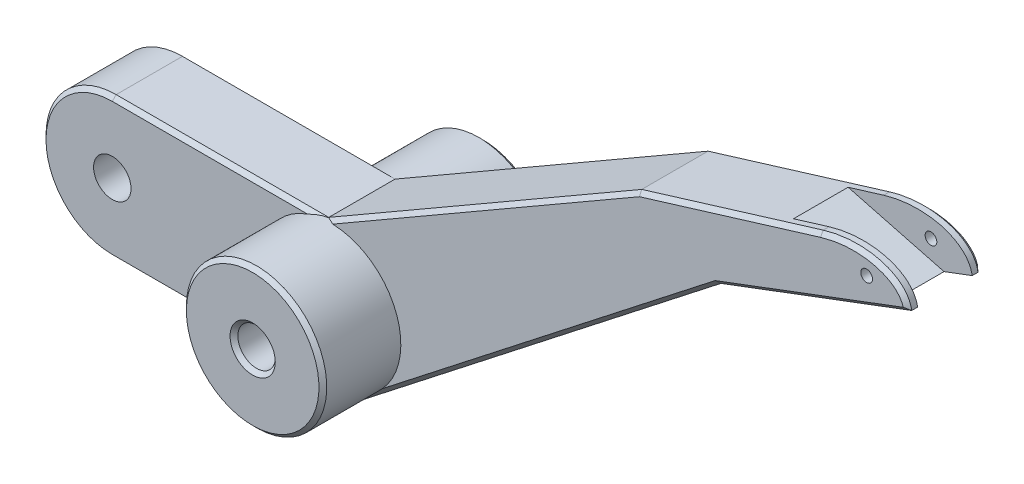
SolidWorks part; units mm, degrees
other "Markup1"
sketch "Sketch7" plane through (10, 10, 14.75) normal (0, 0, 1) x (1, 0, 0)
ref_plane "Front Plane" through (0, 0, 0) normal (0, 0, 1) x (1, 0, 0)
ref_plane "Top Plane" through (0, 0, 0) normal (0, 1, 0) x (1, 0, 0)
ref_plane "Right Plane" through (0, 0, 0) normal (1, 0, 0) x (0, 0, -1)
sketch "Sketch1" plane through (0, 0, 0) normal (0, 0, 1) x (1, 0, 0)
  line L14 (10, 28) -> (46.2616, 28)
  line L15 (10, 28) -> (10, 10)
  line L16 (10, 10) -> (50.7138, 10)
  line L23 (46.2616, 28) -> (86.3978, 51.1726)
  line L24 (50.7138, 10) -> (96.5513, 45.8122)
  line L25 (86.3978, 51.1726) -> (121.4078, 61.8763)
  line L28 (121.0092, 55.0295) -> (96.5513, 45.8122)
  line L29 (121.4078, 61.8763) -> (121.0092, 55.0295)
  circle A1 centre (19, 19) radius 2.4
  circle A3 centre (47, 19) radius 2.4
  circle A4 centre (115.7278, 56.5) radius 0.75
  point P8 (10, 19)
  dimension "D1" = 4.8
  dimension "D3" = 1.5
  dimension "D8" = 4.8
  dimension "D13" = 38
  dimension "D5" = 11.4816
  dimension "D2" = 9
  dimension "D4" = 18
  dimension "D6" = 68.7278
  dimension "D7" = 150
  dimension "D9" = 28
  dimension "D10" = 10
  dimension "D11" = 10
  dimension "D12" = 37.5
  dimension "D15" = 193
  dimension "D16" = 58.1686
  dimension "D17" = 46.3452
  dimension "D19" = 9.7361
extrude "Boss-Extrude1" add sketch "Sketch1" along normal mid plane 9.5
fillet "Fillet1" radius 9 2 edges at (10, 10, 0) (10, 28, 0)
chamfer "Chamfer1" [suppressed] distance 1 angle 45
fillet "Fillet2" radius 5 1 edges at (121.4078, 61.8763, 0)
sketch "Sketch5" plane through (0, 0, 0) normal (0, 0, 1) x (1, 0, 0)
  line L0 (105.1055, 56.8921) -> (121.1496, 52.6907)
  line L1 (109.6643, 58.2859) -> (86.3978, 51.1726) construction
  line L3 (118.7628, 63.16) -> (105.1055, 56.8921)
  line L4 (118.7628, 63.16) -> (129.4726, 58.3019)
  line L5 (129.4726, 58.3019) -> (121.1496, 52.6907)
extrude "Cut-Extrude2" cut sketch "Sketch5" against normal mid plane 7
sketch "Sketch6" plane through (0, 0, 0) normal (0, 0, 1) x (1, 0, 0)
  circle A0 centre (47, 19) radius 2.4
  circle A2 centre (47, 19) radius 9
  dimension "D1" = 4.8
  dimension "D2" = 18
extrude "Boss-Extrude2" add sketch "Sketch6" along normal mid plane 29.5
chamfer "Chamfer2" distance 0.5 angle 45 24 edges at (49.4, 19, 14.75) (49.4, 19, -14.75) (56, 19, -14.75) (56, 19, 14.75) (73.6325, 27.9061, -4.75) (48.8569, 10, -4.75) (33, 10, -4.75) (12.636, 12.636, -4.75) (12.636, 25.364, -4.75) (32.6308, 28, -4.75) (66.3297, 39.5863, -4.75) (73.6325, 27.9061, 4.75) (48.8569, 10, 4.75) (33, 10, 4.75) (12.636, 12.636, 4.75) (12.636, 25.364, 4.75) (66.3297, 39.5863, 4.75) (32.6308, 28, 4.75)
